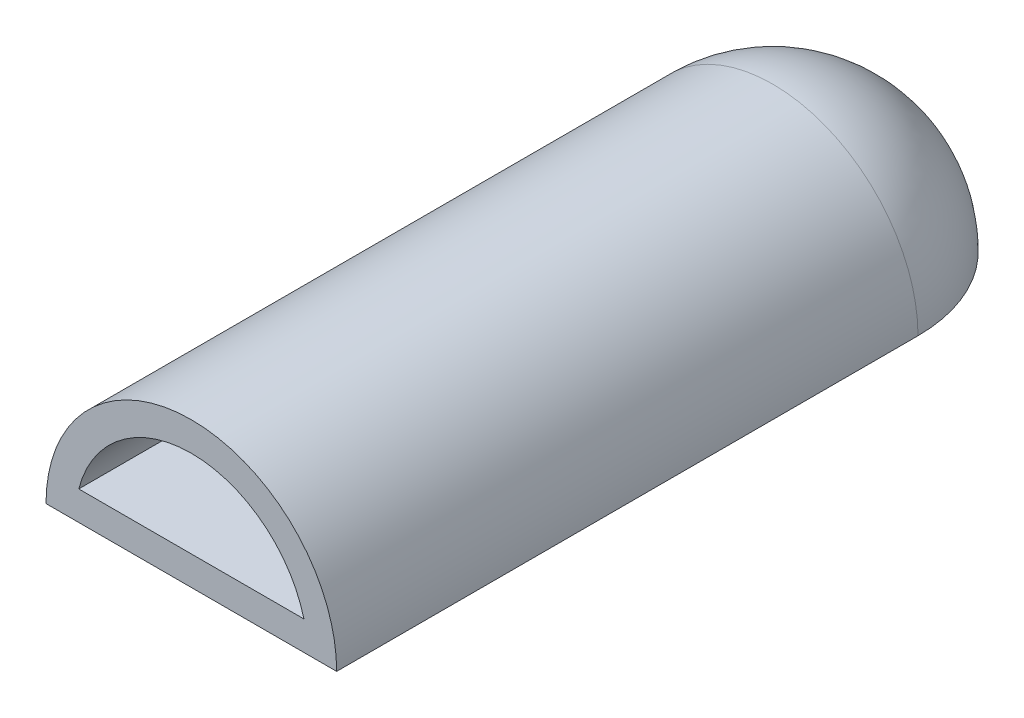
SolidWorks part; units mm, degrees
ref_plane "Front Plane" through (0, 0, 0) normal (0, 0, 1) x (1, 0, 0)
ref_plane "Top Plane" through (0, 0, 0) normal (0, 1, 0) x (1, 0, 0)
ref_plane "Right Plane" through (0, 0, 0) normal (1, 0, 0) x (0, 0, -1)
sketch "Sketch1" plane through (0, 0, 0) normal (0, 0, 1) x (1, 0, 0)
  line L0 (-20, 0) -> (20, 0)
  arc A0 (-20, 0) -> (20, 0) centre (0, 0) cw
  dimension "D1" = 40
extrude "Boss-Extrude1" add sketch "Sketch1" along normal blind 100
fillet "Fillet1" radius 20 1 edges at (0, 20, 0)
shell "Shell1" thickness 4
sketch "Sketch2" plane through (0, 0, 100) normal (0, 0, 1) x (1, 0, 0)
  line L0 (0, 0) -> (0, 20) construction
  line L1 (-20, 0) -> (20, 0) construction
  arc A0 (20, 0) -> (-20, 0) centre (0, 0) ccw construction
  circle A1 centre (0, 10) radius 2.75
  circle A2 centre (-8.4822, 7.4035) radius 2
  dimension "D1" = 5.5
  dimension "D2" = 4
